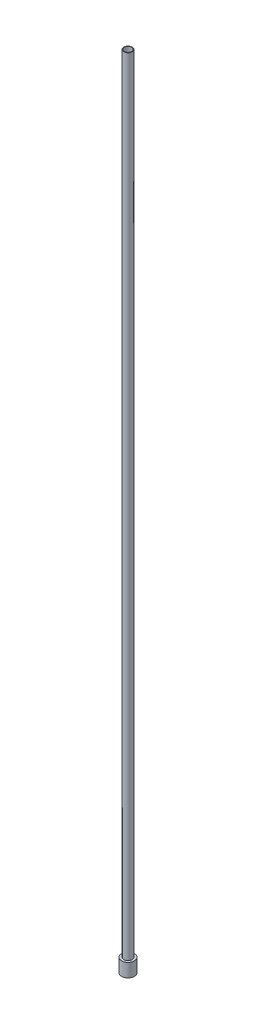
SolidWorks part; units mm, degrees
ref_plane "Front Plane" through (0, 0, 0) normal (0, 0, 1) x (1, 0, 0)
ref_plane "Top Plane" through (0, 0, 0) normal (0, 1, 0) x (1, 0, 0)
ref_plane "Right Plane" through (0, 0, 0) normal (1, 0, 0) x (0, 0, -1)
sketch "Sketch2" plane through (0, 0, 0) normal (0, 0, 1) x (1, 0, 0)
  line L0 (0, 0) -> (0, 304.8) construction
  line L1 (-1.3843, 0) -> (-2.413, 0)
  line L2 (-2.413, 0) -> (-2.413, 5.1562)
  line L3 (-2.413, 5.1562) -> (-1.5875, 5.1562)
  line L4 (-1.5875, 5.1562) -> (-1.5875, 304.8)
  line L5 (-1.5875, 304.8) -> (-1.3843, 304.8)
  line L6 (-1.3843, 0) -> (-1.3843, 304.8)
  dimension "D1" = 5.1562
  dimension "D2" = 4.826
  dimension "D3" = 3.175
  dimension "D4" = 304.8
  dimension "D5" = 2.7686
revolve "Revolve1" add sketch "Sketch2" angle 360 about L0
